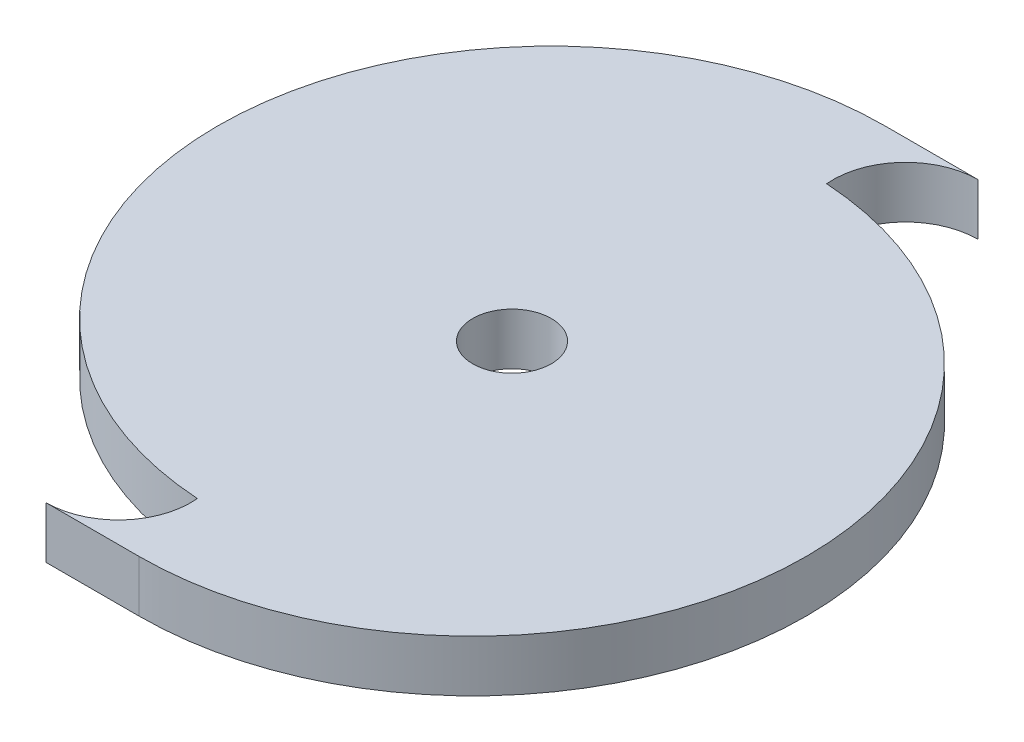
SolidWorks part; units mm, degrees
ref_plane "Front" through (0, 0, 0) normal (0, 0, 1) x (1, 0, 0)
ref_plane "Top" through (0, 0, 0) normal (0, 1, 0) x (1, 0, 0)
ref_plane "Right" through (0, 0, 0) normal (1, 0, 0) x (0, 0, -1)
sketch "Sketch1" plane through (0, 0, 0) normal (0, 1, 0) x (1, 0, 0)
  line L0 (0, 72.1) -> (18, 72.1)
  line L1 (0, -72.1) -> (-18, -72.1)
  circle A0 centre (0, 0) radius 7.6
  arc A1 (-18, -72.1) -> (-4.0631, -56.7719) centre (-18, -58.1) ccw
  arc A2 (0, -72.1) -> (4.0631, 56.7719) centre (0, -7.6) ccw
  arc A3 (0, 72.1) -> (-4.0631, -56.7719) centre (0, 7.6) ccw
  arc A4 (18, 72.1) -> (4.0631, 56.7719) centre (18, 58.1) ccw
  dimension "D5" = 64.5
  dimension "D6" = 64.5
  dimension "D7" = 14
  dimension "D1" = 15.2
  dimension "D4" = 14
  dimension "D2" = 18
  dimension "D3" = 18
extrude "Boss-Extrude1" add sketch "Sketch1" along normal blind 10
